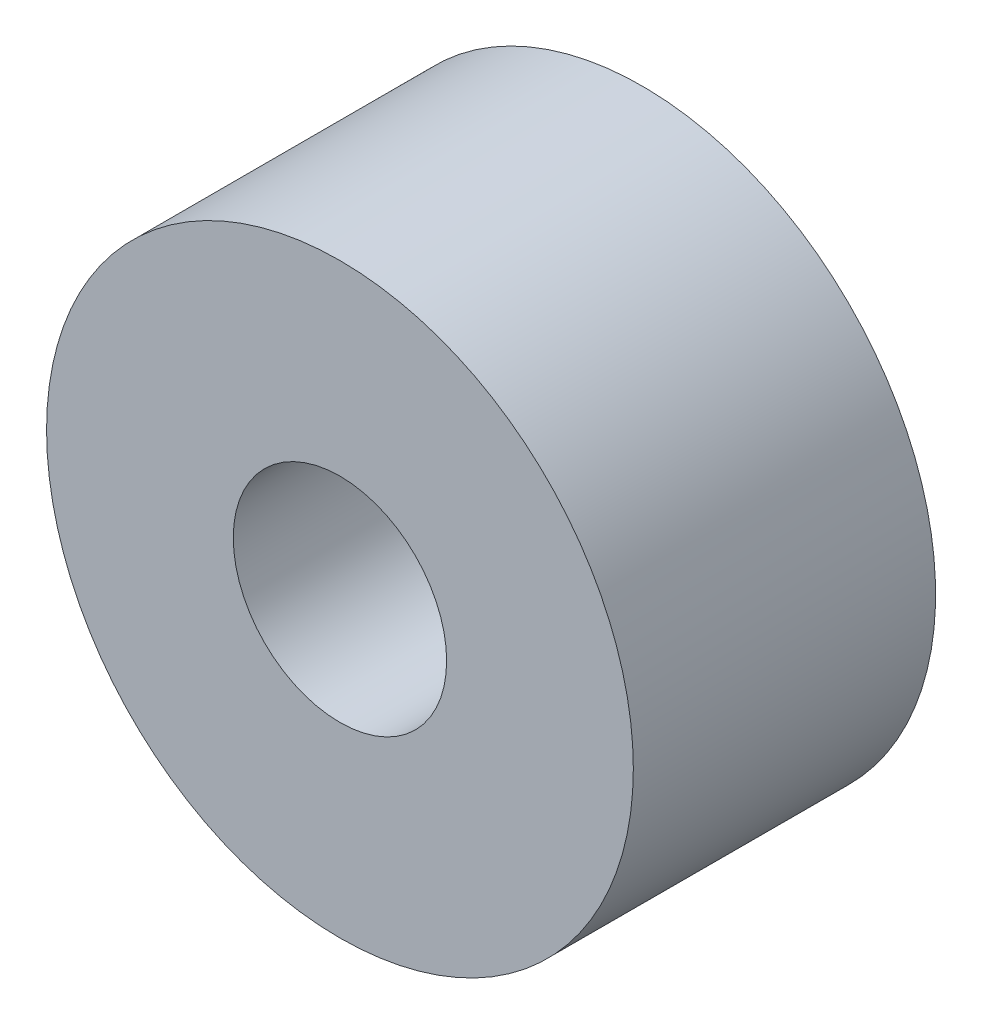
SolidWorks part; units mm, degrees
ref_plane "Plan de face" through (0, 0, 0) normal (0, 0, 1) x (1, 0, 0)
ref_plane "Plan de dessus" through (0, 0, 0) normal (0, 1, 0) x (1, 0, 0)
ref_plane "Plan de droite" through (0, 0, 0) normal (1, 0, 0) x (0, 0, -1)
sketch "Esquisse1" plane through (0, 0, 0) normal (0, 0, 1) x (1, 0, 0)
  circle A0 centre (360, -290) radius 16.5
  circle A1 centre (360, -290) radius 6
  dimension "D1" = 33
  dimension "D2" = 12
extrude "Extrusion1" add sketch "Esquisse1" along normal blind 165
sketch "Esquisse2" plane through (0, 0, 0) normal (0, 0, -1) x (-1, 0, 0)
  circle A0 centre (-360, -290) radius 16.5 construction
  circle A1 centre (-360, -290) radius 16.5
extrude "Enlèv. mat.-Extru.1" cut sketch "Esquisse2" against normal blind 148
